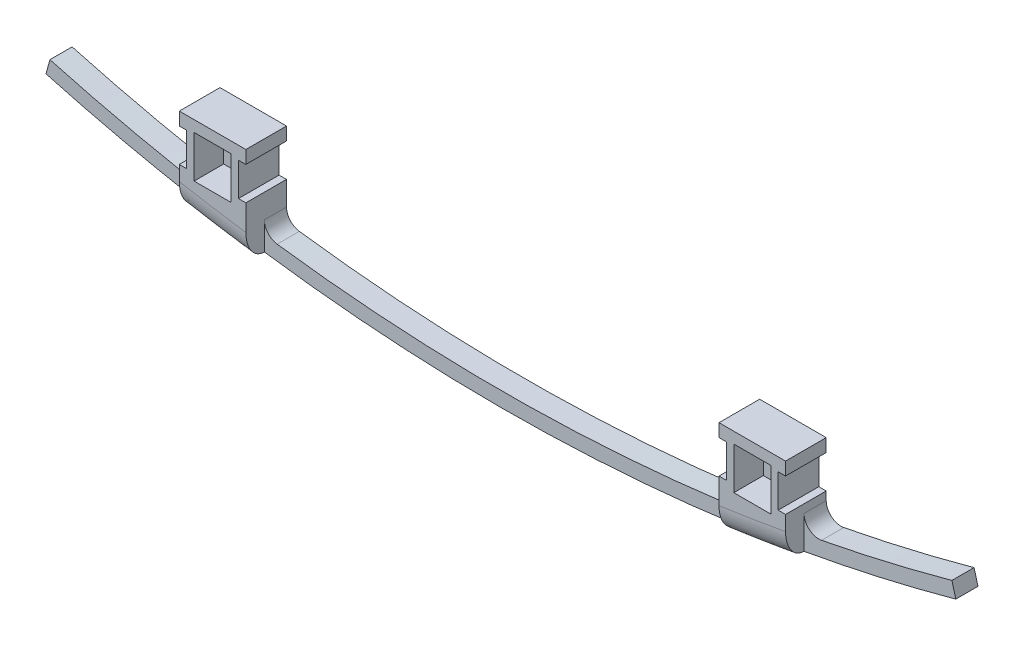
SolidWorks part; units mm, degrees
ref_plane "Plan de face" through (0, 0, 0) normal (0, 0, 1) x (1, 0, 0)
ref_plane "Plan de dessus" through (0, 0, 0) normal (0, 1, 0) x (1, 0, 0)
ref_plane "Plan de droite" through (0, 0, 0) normal (1, 0, 0) x (0, 0, -1)
sketch "Esquisse1" plane through (0, 0, 0) normal (0, 0, 1) x (1, 0, 0)
  line L0 (0, 0) -> (77, 0) construction
  line L1 (-22.5, 5) -> (99.5, 5) construction
  line L2 (38.5, 0) -> (38.5, 19.8037) construction
  line L3 (-23.0313, 3.0719) -> (-22.5, 5)
  line L4 (100.0313, 3.0719) -> (99.5, 5)
  arc A0 (-22.5, 5) -> (99.5, 5) centre (38.5, 226.375) ccw
  arc A1 (-23.0313, 3.0719) -> (100.0313, 3.0719) centre (38.5, 226.375) ccw
  dimension "D1" = 77
  dimension "D2" = 22.5
  dimension "D3" = 5
  dimension "D4" = 2
extrude "Boss.-Extru.1" add sketch "Esquisse1" along normal blind 3
sketch "Esquisse2" plane through (0, 0, 0) normal (0, 0, -1) x (-1, 0, 0)
  line L0 (-77.5, 0.0856) -> (0.5, 0.0856) construction
  line L1 (-38.5, -3.2505) -> (-38.5, 4.1185) construction
  arc A0 (-99.5, 5) -> (22.5, 5) centre (-38.5, 226.375) ccw construction
  dimension "D1" = 78
ref_plane "Plan1" through (38.5, 0, 0) normal (1, 0, 0) x (0, 1, 0)
ref_plane "Plan2" through (77.5, 0, 0) normal (1, 0, 0) x (0, 1, 0)
sketch "Esquisse3" plane through (0, 0, 3) normal (0, 0, 1) x (1, 0, 0)
  line L0 (-0.5, 0.0856) -> (-0.5, 14.748) construction
  line L1 (77.5, 0.0856) -> (-0.5, 0.0856) construction
  line L2 (-0.5, 3.0283) -> (4.5, 3.0283)
  line L3 (-0.5, 3.0283) -> (-0.5, 8.7283)
  line L4 (-0.5, 8.7283) -> (4.5, 8.7283)
  line L5 (4.5, 3.0283) -> (4.5, 8.7283)
  line L6 (-2.5, 10.2283) -> (6.5, 10.2283)
  line L7 (6.5, 1.5283) -> (6.5, 10.2283)
  line L8 (38.5, -5.2505) -> (38.5, 14.748) construction
  line L9 (-2.5, 1.5283) -> (-2.5, 10.2283)
  line L10 (-2.5, 1.5283) -> (-2.5, -1.593)
  line L11 (6.5, 1.5283) -> (6.5, -3.0294)
  line L12 (38.5, -4.053) -> (38.5, 4.053) construction
  line L14 (77.5, 0.0856) -> (77.5, 14.748) construction
  line L15 (70.5, 1.5283) -> (70.5, -3.0294)
  line L16 (79.5, 1.5283) -> (79.5, -1.593)
  line L17 (79.5, 1.5283) -> (79.5, 10.2283)
  line L18 (70.5, 1.5283) -> (70.5, 10.2283)
  line L19 (79.5, 10.2283) -> (70.5, 10.2283)
  line L20 (72.5, 3.0283) -> (72.5, 8.7283)
  line L21 (77.5, 8.7283) -> (72.5, 8.7283)
  line L22 (77.5, 3.0283) -> (77.5, 8.7283)
  line L23 (77.5, 3.0283) -> (72.5, 3.0283)
  arc A0 (-23.0313, 3.0719) -> (100.0313, 3.0719) centre (38.5, 226.375) ccw construction
  arc A1 (-2.5, -1.593) -> (6.5, -3.0294) centre (38.5, 226.375) ccw
  arc A2 (79.5, -1.593) -> (70.5, -3.0294) centre (38.5, 226.375) cw
  dimension "D1" = 5
  dimension "D2" = 5.7
  dimension "D3" = 2.9427
  dimension "D4" = 1.5
  dimension "D5" = 2
  dimension "D6" = 2
extrude "Boss.-Extru.3" add sketch "Esquisse3" along normal blind 2.5 and the other way up to vertex
sketch "Esquisse4" plane through (0, 0, 0) normal (0, 0, -1) x (-1, 0, 0)
  line L1 (-77.5, 8.7283) -> (-72.5, 8.7283)
  line L2 (-77.5, 8.7283) -> (-77.5, 3.0283)
  line L3 (-77.5, 3.0283) -> (-72.5, 3.0283)
  line L4 (-72.5, 8.7283) -> (-72.5, 3.0283)
  line L5 (-4.5, 8.7283) -> (0.5, 8.7283)
  line L6 (-4.5, 8.7283) -> (-4.5, 3.0283)
  line L7 (-4.5, 3.0283) -> (0.5, 3.0283)
  line L8 (0.5, 8.7283) -> (0.5, 3.0283)
extrude "Boss.-Extru.4" add sketch "Esquisse4" against normal blind 1.5
sketch "Esquisse5" plane through (0, 0, 5.5) normal (0, 0, 1) x (1, 0, 0)
  line L0 (-2.5, 10.2283) -> (-2.5, -1.593) construction
  line L1 (-2.5, 8.4783) -> (-1.5, 8.4783)
  line L2 (-2.5, 8.4783) -> (-2.5, 3.9783)
  line L3 (-2.5, 3.9783) -> (-1.5, 3.9783)
  line L4 (-1.5, 8.4783) -> (-1.5, 3.9783)
  line L5 (2, 8.7283) -> (2, 3.0283) construction
  line L6 (4.5, 8.7283) -> (-0.5, 8.7283) construction
  line L7 (4.5, 3.0283) -> (-0.5, 3.0283) construction
  line L8 (38.5, -3.2505) -> (38.5, 17.1677) construction
  line L9 (38.5, -4.053) -> (38.5, 4.053) construction
  line L10 (-0.5, 8.7283) -> (4.5, 8.7283) construction
  line L11 (5.5, 8.4783) -> (5.5, 3.9783)
  line L12 (6.5, 3.9783) -> (5.5, 3.9783)
  line L13 (6.5, 8.4783) -> (6.5, 3.9783)
  line L14 (6.5, 8.4783) -> (5.5, 8.4783)
  line L15 (75, 8.7283) -> (75, 3.0283) construction
  line L16 (70.5, 8.4783) -> (71.5, 8.4783)
  line L17 (70.5, 8.4783) -> (70.5, 3.9783)
  line L18 (70.5, 3.9783) -> (71.5, 3.9783)
  line L19 (71.5, 8.4783) -> (71.5, 3.9783)
  line L20 (78.5, 8.4783) -> (78.5, 3.9783)
  line L21 (79.5, 3.9783) -> (78.5, 3.9783)
  line L22 (79.5, 8.4783) -> (79.5, 3.9783)
  line L23 (79.5, 8.4783) -> (78.5, 8.4783)
  dimension "D1" = 0.25
  dimension "D2" = 4.5
  dimension "D3" = 1
extrude "Enlèv. mat.-Extru.1" cut sketch "Esquisse5" against normal up to vertex
fillet "Congé2" radius 2.5 2 edges at (75.0071, -2.3555, 5.5) (1.9929, -2.3555, 5.5)
fillet "Congé3" radius 2 4 edges at (6.5, -1.0099, 1.5) (-2.5, 0.4394, 1.5) (70.5, -1.0099, 1.5) (79.5, 0.4394, 1.5)
